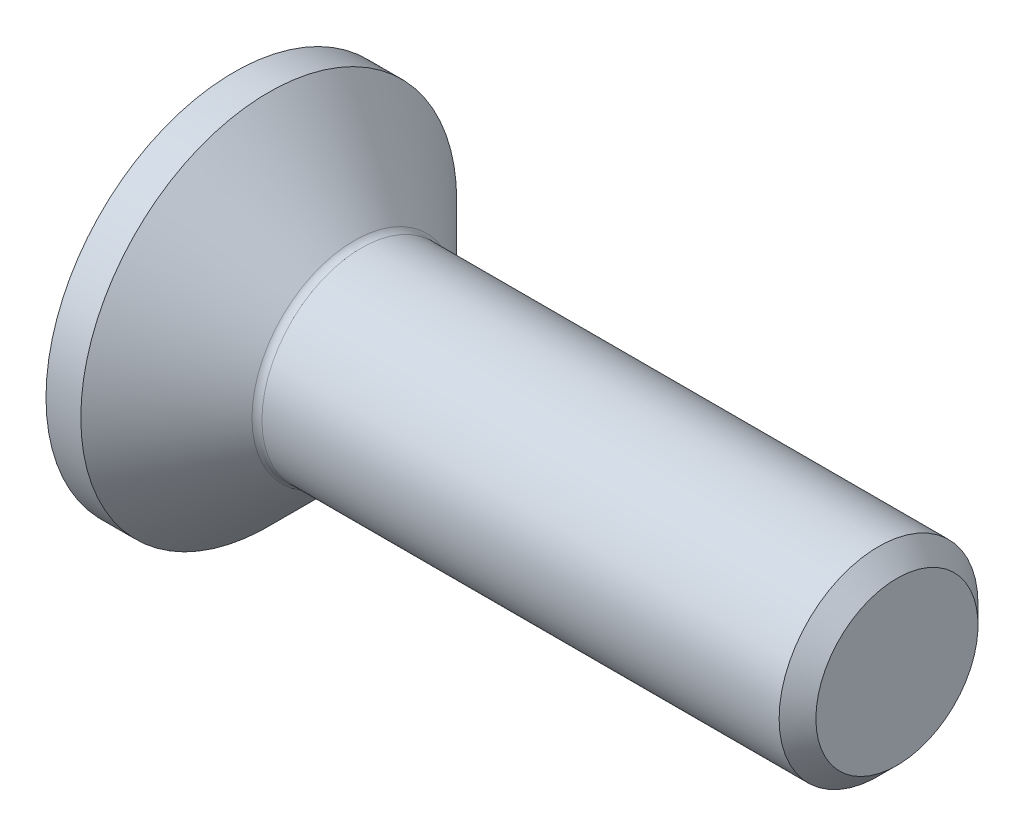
SolidWorks part; units mm, degrees
ref_plane "Plane1" through (0, 0, 0) normal (0, 0, 1) x (1, 0, 0)
ref_plane "Plane2" through (0, 0, 0) normal (0, 1, 0) x (1, 0, 0)
ref_plane "Plane3" through (0, 0, 0) normal (1, 0, 0) x (0, 0, -1)
sketch "BodySke" plane through (0, 0, 0) normal (0, 0, 1) x (1, 0, 0)
  line L0 (0, 0) -> (0, 5.67)
  line L1 (1.05, 5.67) -> (3.72, 3)
  line L2 (0, 5.67) -> (1.05, 5.67)
  line L3 (3.72, 3) -> (19.4455, 3)
  line L4 (20, 2.4455) -> (20, 0)
  line L5 (20, 0) -> (0, 0)
  line L6 (0, 0) -> (127, 0) construction
  line L7 (1.05, -5.67) -> (3.72, -3) construction
  line L8 (20, 2.4455) -> (19.4455, 3)
  line L9 (0, -5.67) -> (1.05, -5.67) construction
  line L10 (20, -2.4455) -> (19.4455, -3) construction
  line L11 (4.72, 9.35) -> (4.72, -12.875) construction
  line L12 (0, 16.35) -> (0, -5.875) construction
  dimension "Diameter" = 6
  dimension "Head_ht" = 3.72
  dimension "Length" = 20
  dimension "Body_ch_ang" = 45
  dimension "Head_dia" = 11.34
  dimension "Minor_dia" = 4.891
  dimension "Head_ang" = 90
  dimension "Advance" = 1
  dimension "Thread_nom" = 20
revolve "BaseBody" add sketch "BodySke" angle 360 about L6
fillet "Fillet1" radius 0.3 1 edges at (3.72, 0, 3)
sketch "Sketch2" plane through (0, 0, 0) normal (0, 0, 1) x (1, 0, 0)
  line L0 (0, 2.01) -> (2.2, 2.01)
  line L1 (2.2, 2.01) -> (3.3605, 0)
  line L2 (0, 0) -> (127, 0) construction
  line L3 (3.3605, 0) -> (0, 0)
  line L4 (0, 0) -> (0, 2.01)
  line L5 (0, -2.01) -> (2.2, -2.01) construction
  line L6 (0, 0) -> (47.625, 0) construction
  line L8 (0, 5.67) -> (0, -5.67) construction
  dimension "D2" = 60
  dimension "PreBroach_depth" = 2.2
  dimension "PreBroach_dia" = 4.02
revolve "PreBroach" cut sketch "Sketch2" angle 360 about L6
sketch "Sketch3" plane through (0, 0, 0) normal (-1, 0, 0) x (0, 0, 1)
  line L0 (-2.01, -1.1605) -> (-2.01, 1.1605)
  line L1 (-2.01, 1.1605) -> (0, 2.3209)
  line L2 (0, 2.3209) -> (2.01, 1.1605)
  line L3 (2.01, 1.1605) -> (2.01, -1.1605)
  line L4 (2.01, -1.1605) -> (0, -2.3209)
  line L5 (0, -2.3209) -> (-2.01, -1.1605)
  dimension "D1" = 2.01
  dimension "D2" = 2.01
  dimension "D3" = 4.02
  dimension "Hex_size" = 4.02
extrude "Hex" cut sketch "Sketch3" against normal blind 2.2
sketch "ThdSchSke" plane through (0, 0, 0) normal (0, 0, 1) x (1, 0, 0)
  line L0 (5.22, -2.4455) -> (4.8317, -3)
  line L1 (5.22, -2.4455) -> (5.6083, -3)
  line L2 (5.6083, -3) -> (5.6083, -3.75)
  line L3 (-3.175, 0) -> (5.1513, 0) construction
  line L4 (0, 5.67) -> (0, -5.67) construction
  line L5 (5.6083, -3.75) -> (4.8317, -3.75)
  line L6 (4.8317, -3.75) -> (4.8317, -3)
  dimension "Thread_minor" = 4.891
  dimension "Diameter" = 6
  dimension "Start" = 5.22
  dimension "SideAngle" = 55
  dimension "VeeAngle" = 70
  dimension "Overcut" = 7.5
revolve "ThreadSchematic" [suppressed] cut sketch "ThdSchSke" angle 360 about L3
pattern_linear "ThdSchPat" [suppressed]
equation "\"Thread_minor@ThreadCosmetic\"  =  \"Minor_dia@BodySke\""
equation "\"D1@Sketch3\" = \"Hex_size@Sketch3\" / 2"
equation "\"D2@Sketch3\" = \"D1@Sketch3\""
equation "\"D3@Sketch3\" = \"Hex_size@Sketch3\""
equation "\"Thread_length@ThreadCosmetic\" = ((sgn( (\"Length@BodySke\" - \"Advance@BodySke\" * 1.5 - \"Head_ht@BodySke\" ) - \"Thread_nom@BodySke\" )-1)*( (\"Length@BodySke\" - \"Advance@BodySke\" * 1.5 - \"Head_ht@BodySke\" "
equation "\"Thread_minor@ThdSchSke\" = \"Minor_dia@BodySke\""
equation "\"Diameter@ThdSchSke\" = \"Diameter@BodySke\""
equation "\"Overcut@ThdSchSke\" = \"Diameter@BodySke\" * 1.25"
equation "\"Start@ThdSchSke\" = 0.000001 + \"Length@BodySke\" - \"Thread_length@ThreadCosmetic\"  '---Countersunk---"
equation "\"Num_threads@ThdSchPat\" = int( \"Thread_length@ThreadCosmetic\" / \"Advance@BodySke\" + 0.999 )  + 1"
equation "\"Advance@ThdSchPat\" = \"Thread_length@ThreadCosmetic\" /  (\"Num_threads@ThdSchPat\" - 1) 'relax it"
equation "\"Num_threads@ThdSchPat\" = \"Num_threads@ThdSchPat\" - sgn( \"Num_threads@ThdSchPat\" - 1) '---chamfered tips only---"
